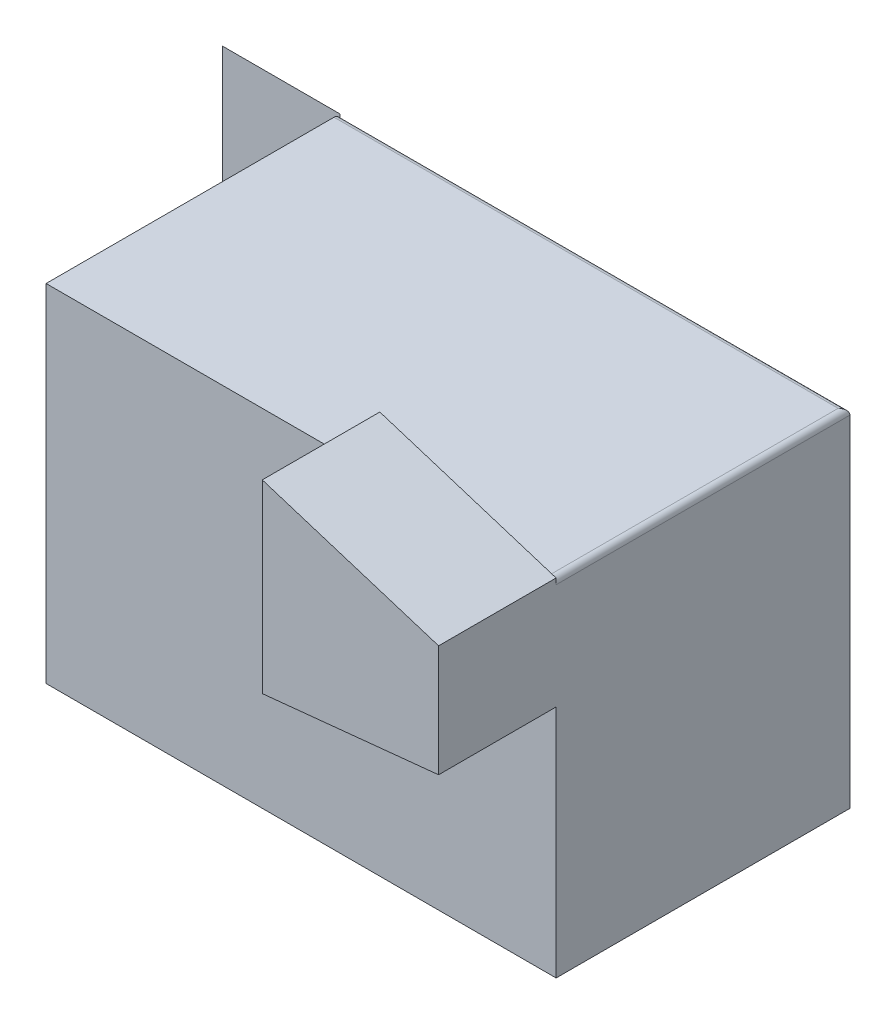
SolidWorks part; units mm, degrees
ref_plane "Front" through (0, 0, 0) normal (0, 0, 1) x (1, 0, 0)
ref_plane "Top" through (0, 0, 0) normal (0, 1, 0) x (1, 0, 0)
ref_plane "Right" through (0, 0, 0) normal (1, 0, 0) x (0, 0, -1)
sketch "Sketch1" plane through (0, 0, 0) normal (0, 0, 1) x (1, 0, 0)
  line L1 (41.7626, 29.1519) -> (-45.0381, 29.1519)
  line L2 (41.7626, 29.1519) -> (41.7626, -29.807)
  line L3 (41.7626, -29.807) -> (-45.0381, -29.807)
  line L4 (-45.0381, 29.1519) -> (-45.0381, -29.807)
extrude "Extrude1" add sketch "Sketch1" along normal mid plane 50
sketch "Sketch2" plane through (0, 0, 25) normal (0, 0, 1) x (1, 0, 0)
  line L0 (41.7626, 29.1519) -> (41.7626, 10.1429)
  line L1 (41.7626, -29.807) -> (41.7626, 29.1519) construction
  line L2 (41.7626, 29.1519) -> (11.7557, 38.6042)
  line L3 (11.7557, 38.6042) -> (11.7557, 7.1037)
  line L4 (11.7557, 7.1037) -> (41.7626, 10.1429)
extrude "Extrude2" add sketch "Sketch2" along normal blind 20
fillet "Fillet1" radius 1 1 edges at (41.7626, 29.1519, 0)
sketch "Sketch3" plane through (-45.0381, 0, 0) normal (-1, 0, 0) x (0, 0, 1)
  line L0 (-25, 29.1519) -> (-25, -29.807) construction
  line L1 (-25, 29.1519) -> (-25, -29.807)
surface "Surface-Extrude1" sketch "Sketch3" parameters "D1"=20
fillet "Fillet2" radius 1 1 edges at (-2.1377, 29.1519, -25)
